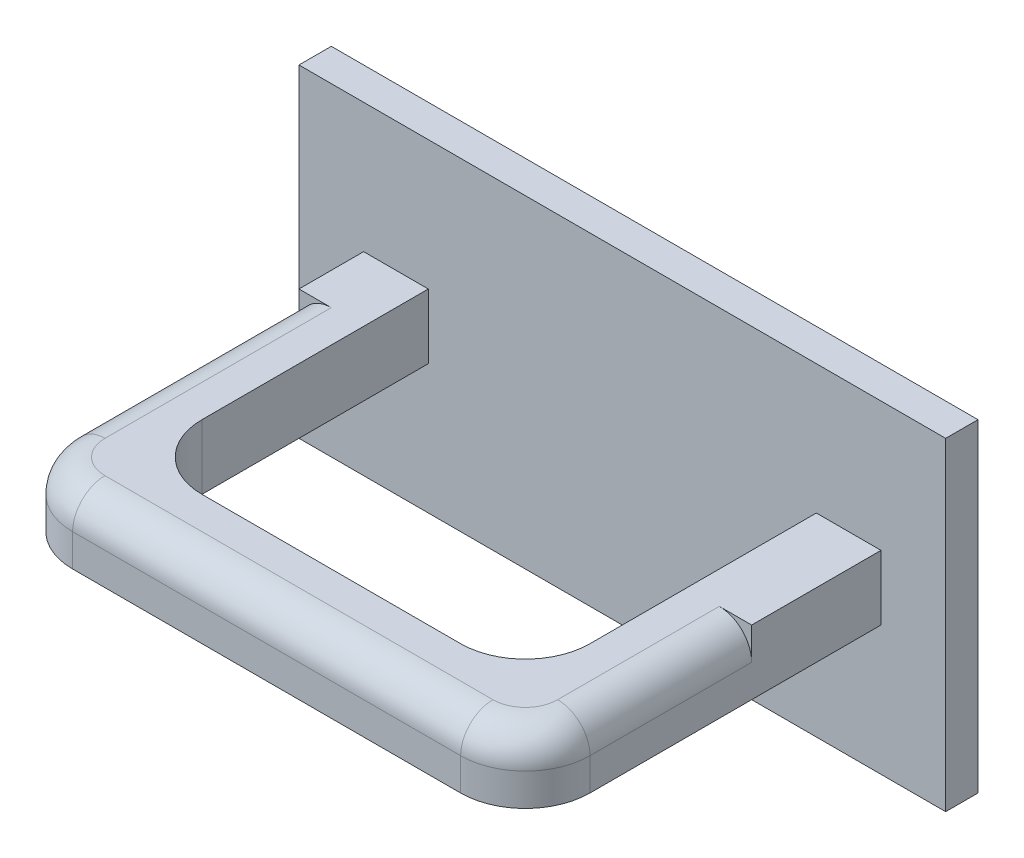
SolidWorks part; units mm, degrees
ref_plane "Front Plane" through (0, 0, 0) normal (0, 0, 1) x (1, 0, 0)
ref_plane "Top Plane" through (0, 0, 0) normal (0, 1, 0) x (1, 0, 0)
ref_plane "Right Plane" through (0, 0, 0) normal (1, 0, 0) x (0, 0, -1)
sketch "Sketch1" plane through (0, 0, 0) normal (0, 0, 1) x (1, 0, 0)
  line L1 (-50, 25) -> (50, 25)
  line L2 (-50, 25) -> (-50, -25)
  line L3 (-50, -25) -> (50, -25)
  line L4 (50, 25) -> (50, -25)
  line L5 (-50, 25) -> (50, -25) construction
  line L6 (-50, -25) -> (50, 25) construction
  point P0 (0, 0)
  dimension "D1" = 100
  dimension "D2" = 50
extrude "Boss-Extrude1" add sketch "Sketch1" along normal blind 5 contours L1 L4 L3 L2
sketch "Sketch2" plane through (0, 0, 0) normal (0, 1, 0) x (1, 0, 0)
  line L0 (-40, -5) -> (-40, -60)
  line L1 (-40, -60) -> (40, -60)
  line L2 (40, -60) -> (40, -5)
  line L3 (40, -5) -> (30, -5)
  line L4 (30, -5) -> (30, -50)
  line L5 (30, -50) -> (-30, -50)
  line L6 (-30, -50) -> (-30, -5)
  line L7 (-30, -5) -> (-40, -5)
  line L8 (-50, -5) -> (50, -5) construction
  line L9 (50, -5) -> (50, 0) construction
  line L10 (-50, -5) -> (-50, 0) construction
  dimension "D1" = 10
  dimension "D2" = 10
  dimension "D3" = 10
  dimension "D4" = 10
  dimension "D5" = 10
  dimension "D6" = 50
extrude "Boss-Extrude2" add sketch "Sketch2" along normal mid plane 10
fillet "Fillet1" radius 10 4 edges at (-30, 0, 50) (-40, 0, 60) (40, 0, 60) (30, 0, 50)
fillet "Fillet2" radius 5 3 edges at (0, 5, 60) (37.0711, 5, 57.0711) (-37.0711, 5, 57.0711)
